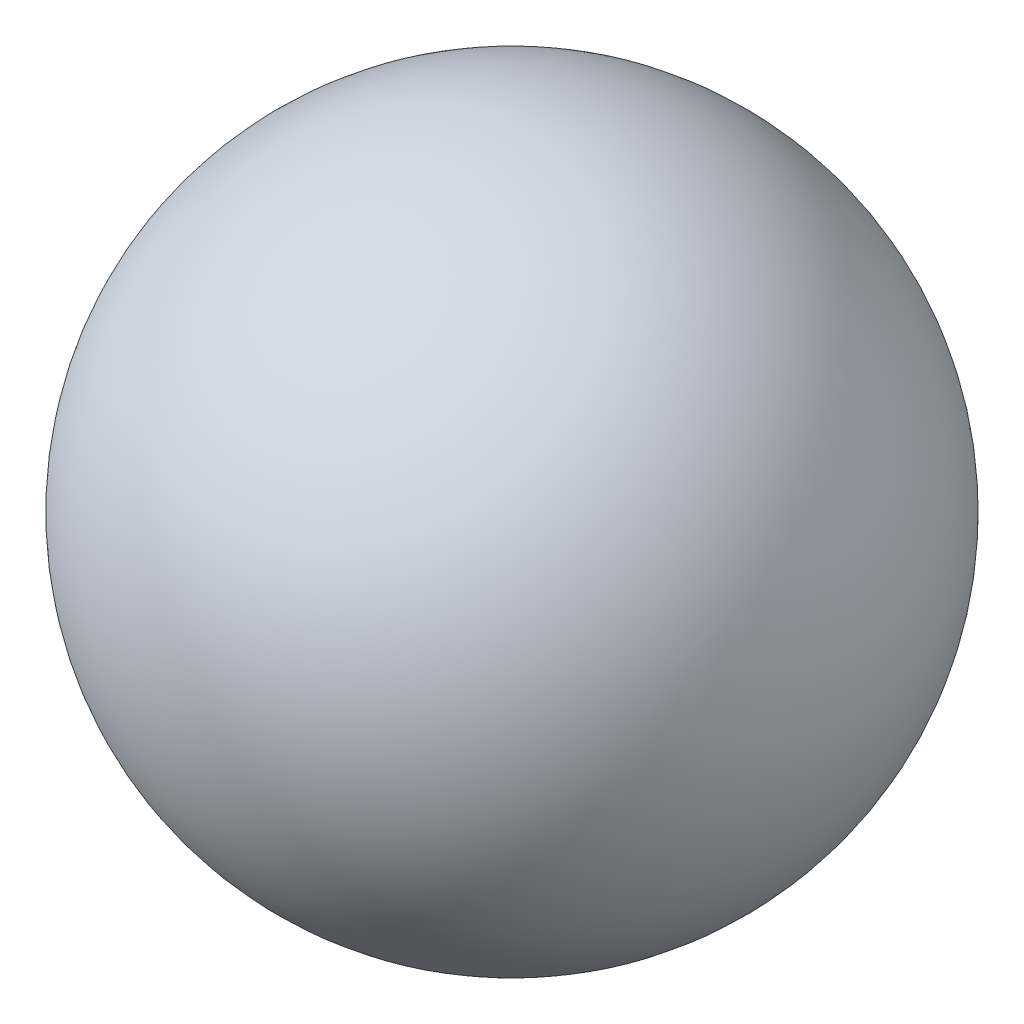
SolidWorks part; units mm, degrees
ref_plane "Face" through (0, 0, 0) normal (0, 0, 1) x (1, 0, 0)
ref_plane "Dessus" through (0, 0, 0) normal (0, 1, 0) x (1, 0, 0)
ref_plane "Droite" through (0, 0, 0) normal (1, 0, 0) x (0, 0, -1)
sketch "Esquisse1" plane through (0, 0, 0) normal (0, 0, 1) x (1, 0, 0)
  line L0 (0, 0) -> (0, 19.093) construction
  line L1 (0, 9.7383) -> (0, 2.7383)
  arc A0 (0, 2.7383) -> (0, 9.7383) centre (0, 6.2383) ccw
  dimension "D1" = 7
revolve "Base-Révolution" add sketch "Esquisse1" angle 360 about L0
